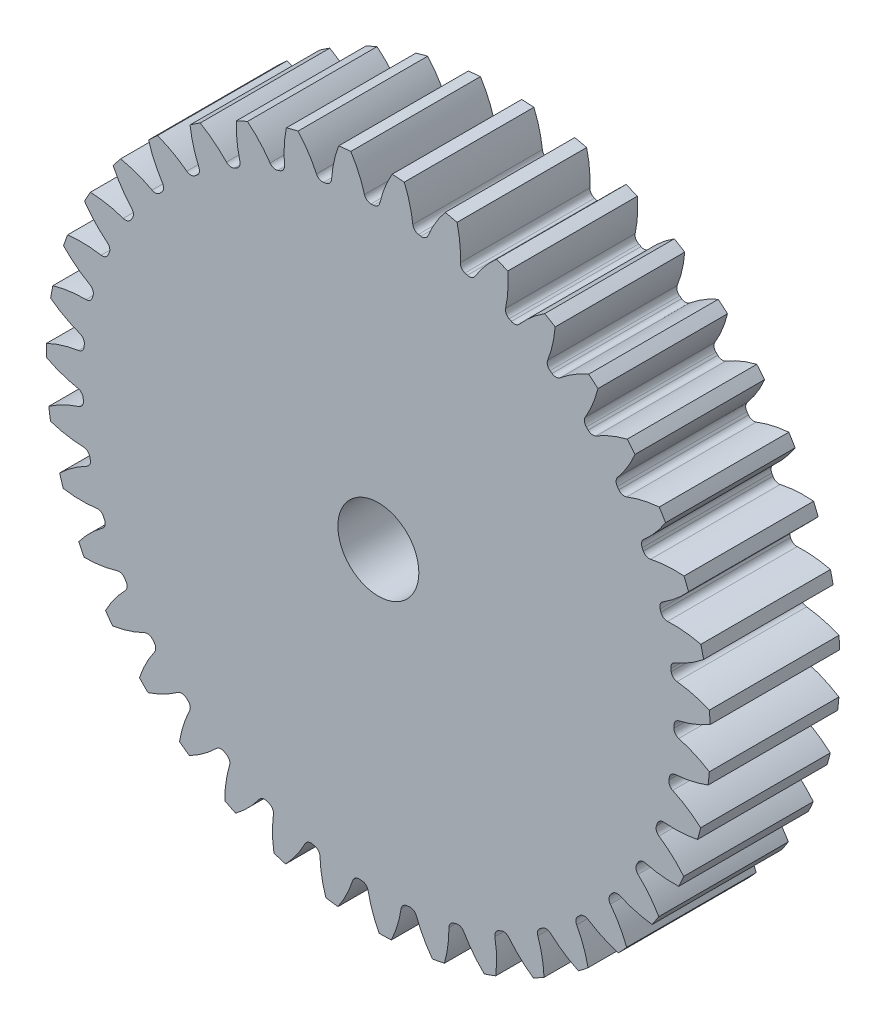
SolidWorks part; units mm, degrees
ref_plane "Front" through (0, 0, 0) normal (0, 0, 1) x (1, 0, 0)
ref_plane "Top" through (0, 0, 0) normal (0, 1, 0) x (1, 0, 0)
ref_plane "Right" through (0, 0, 0) normal (1, 0, 0) x (0, 0, -1)
sketch "Sketch3" plane through (0, 0, 0) normal (0, 0, 1) x (1, 0, 0)
  circle A0 centre (0, 0) radius 260.35
  dimension "od" = 520.7
extrude "gearBody" add sketch "Sketch3" along normal blind 101.6
sketch "Sketch2" plane through (0, 0, 0) normal (0, 0, 1) x (1, 0, 0)
  line L0 (0, 0) -> (215.0005, 89.0561) construction
  line L1 (259.7126, -21.4016) -> (0, 0) construction
  line L2 (0, 0) -> (36.3143, 0) construction
  line L3 (247.5974, 5.1036) -> (247.2095, -14.7635) construction
  line L5 (247.4035, -4.8299) -> (0, 0) construction
  line L7 (0, 0) -> (232.7149, 0) construction
  arc A0 (232.7136, 0.7565) -> (232.5068, -9.8388) centre (0, 0) ccw construction
  arc A1 (260.1128, 11.1109) -> (259.4809, -21.2547) centre (0, 0) ccw construction
  arc A2 (247.5974, 5.1036) -> (247.2095, -14.7635) centre (0, 0) ccw construction
  arc A3 (231.7095, -5.5114) -> (231.748, -3.5365) centre (0, 0) ccw
  arc A4 (259.7126, -21.4016) -> (235.4919, -10.6142) centre (211.3608, -97.3798) ccw
  arc A5 (259.7126, -21.4016) -> (260.35, 11.2487) centre (0, 0) ccw
  arc A6 (260.35, 11.2487) -> (235.7267, 1.4148) centre (215.0005, 89.0561) cw
  arc A7 (231.748, -3.5365) -> (235.7267, 1.4148) centre (236.9163, -3.6153) cw
  arc A8 (235.4919, -10.6142) -> (231.7095, -5.5114) centre (236.8769, -5.6343) cw
  point P6 (260.35, 11.2487)
  point P22 (259.7126, -21.4016)
  dimension "baseDia" = 465.4298
  dimension "od" = 520.7
  dimension "pd" = 495.3
  dimension "rd" = 463.55
  dimension "rFillet" = 5.1689
  dimension "pointX" = 260.35
  dimension "pointY" = 11.2487
  dimension "CTT" = 19.8672
  dimension "flankCenterAngle" = 22.5
extrude "toothCut" cut sketch "Sketch2" along normal through all
pattern_circular "CirPattern1" count 39 over 360 about axis through (0, 0, 0) along (0, 0, 1) of "toothCut"
sketch "hub1Dia" plane through (0, 0, 0) normal (0, 0, -1) x (-1, 0, 0)
  circle A0 centre (0, 0) radius 12.7
  dimension "hub1Dia" = 25.4
sketch "hub2Dia" plane through (0, 0, 101.6) normal (0, 0, 1) x (1, 0, 0)
  circle A0 centre (0, 0) radius 12.7
  dimension "hub2dia" = 25.4
sketch "boreDia" plane through (0, 0, 0) normal (0, 0, 1) x (1, 0, 0)
  circle A0 centre (0, 0) radius 31.75
  dimension "boreDia" = 63.5
extrude "bore" cut sketch "boreDia" against normal mid plane 25400
